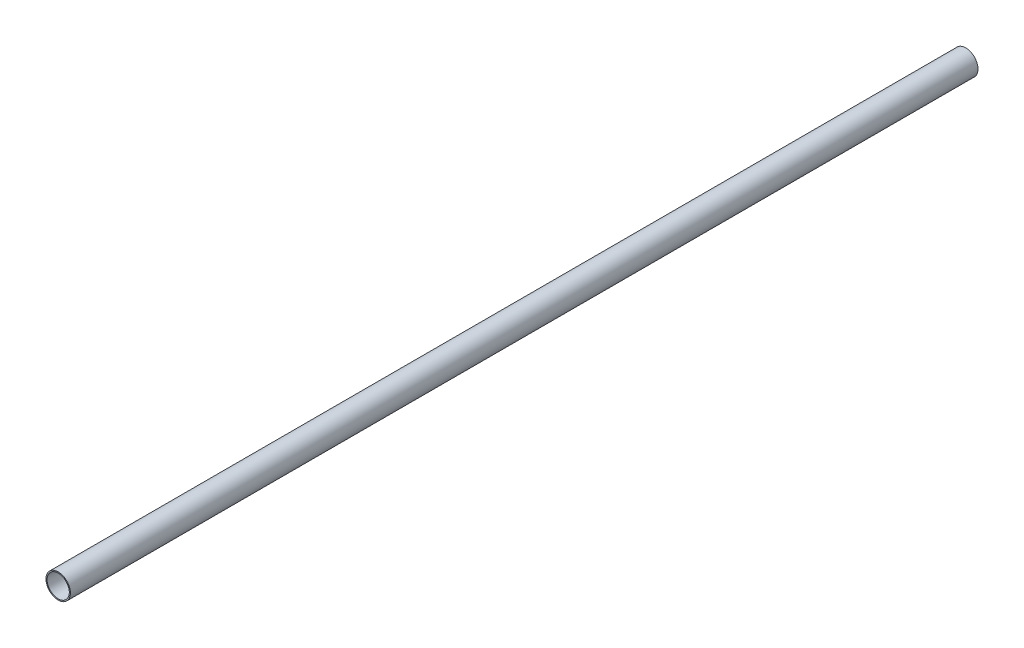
SolidWorks part; units mm, degrees
ref_plane "Plan de face" through (0, 0, 0) normal (0, 0, 1) x (1, 0, 0)
ref_plane "Plan de dessus" through (0, 0, 0) normal (0, 1, 0) x (1, 0, 0)
ref_plane "Plan de droite" through (0, 0, 0) normal (1, 0, 0) x (0, 0, -1)
sketch "Esquisse1" plane through (0, 0, 0) normal (0, 0, 1) x (1, 0, 0)
  circle A0 centre (0, 0) radius 3.3
  circle A1 centre (0, 0) radius 3
  dimension "D1" = 6
  dimension "D2" = 6.6
extrude "Extrusion1" add sketch "Esquisse1" along normal mid plane 245
